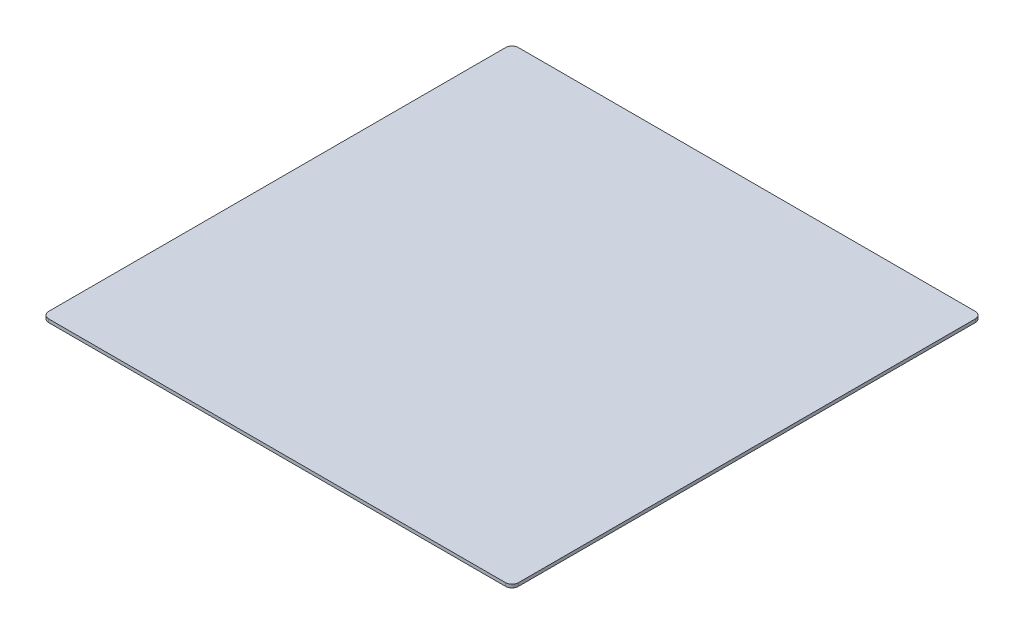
SolidWorks part; units mm, degrees
ref_plane "Front Plane" through (0, 0, 0) normal (0, 0, 1) x (1, 0, 0)
ref_plane "Top Plane" through (0, 0, 0) normal (0, 1, 0) x (1, 0, 0)
ref_plane "Right Plane" through (0, 0, 0) normal (1, 0, 0) x (0, 0, -1)
sketch "Sketch1" plane through (0, 0, 0) normal (0, 1, 0) x (1, 0, 0)
  line L1 (-228.6, -228.6) -> (228.6, -228.6)
  line L2 (-228.6, -228.6) -> (-228.6, 228.6)
  line L3 (-228.6, 228.6) -> (228.6, 228.6)
  line L4 (228.6, -228.6) -> (228.6, 228.6)
  line L5 (-228.6, -228.6) -> (228.6, 228.6) construction
  line L6 (-228.6, 228.6) -> (228.6, -228.6) construction
  point P0 (0, 0)
  dimension "D1" = 457.2
  dimension "D2" = 457.2
extrude "Boss-Extrude1" add sketch "Sketch1" along normal blind 3.175
fillet "Fillet1" radius 6.35 4 edges at (-228.6, 1.5875, -228.6) (228.6, 1.5875, -228.6) (228.6, 1.5875, 228.6) (-228.6, 1.5875, 228.6)
